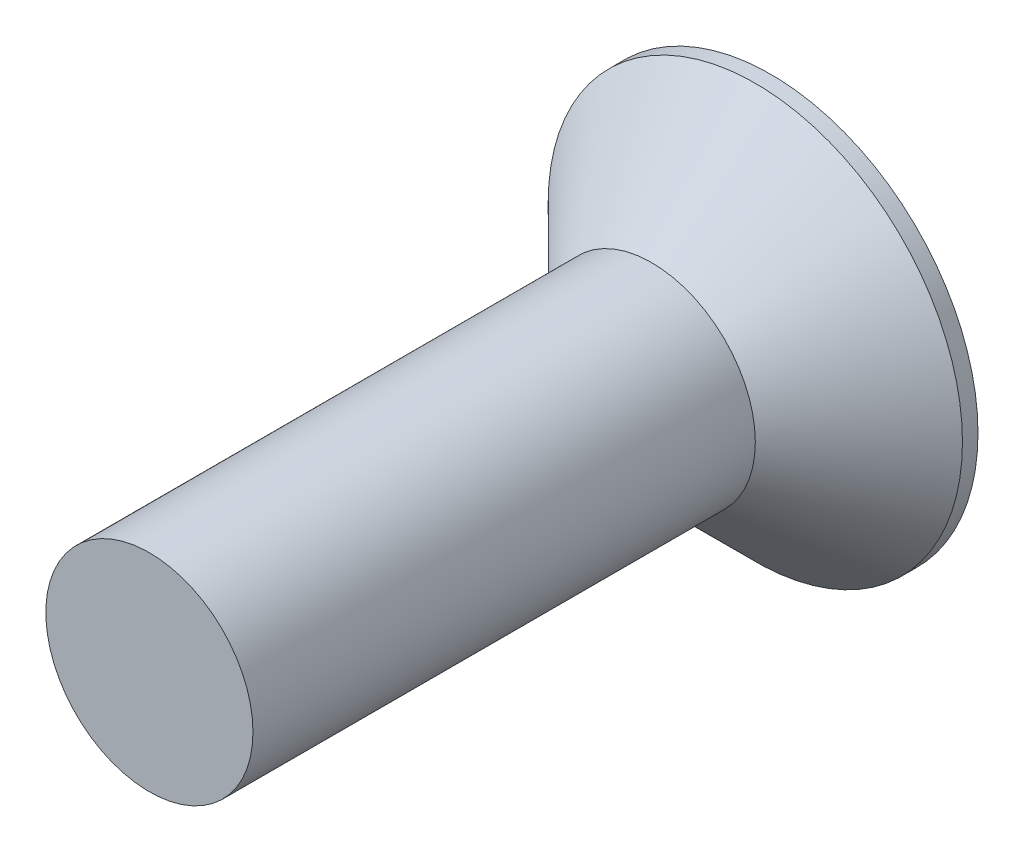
SolidWorks part; units mm, degrees
ref_plane "Front Plane" through (0, 0, 0) normal (0, 0, 1) x (1, 0, 0)
ref_plane "Top Plane" through (0, 0, 0) normal (0, 1, 0) x (1, 0, 0)
ref_plane "Right Plane" through (0, 0, 0) normal (1, 0, 0) x (0, 0, -1)
sketch "Sketch6" plane through (0, 0, 0) normal (1, 0, 0) x (0, 0, -1)
  line L0 (-12, 0) -> (22.525, 0) construction
  line L1 (4.4, 0) -> (-4.4, 0) construction
  line L2 (-12, 0) -> (-12, -2)
  line L3 (-12, -2) -> (-2.3, -2)
  line L5 (-0.3, -4) -> (0, -4)
  line L6 (-2.3, -2) -> (-0.3, -4)
  line L7 (0, -4) -> (0, 0)
  line L8 (0, 0) -> (-12, 0)
  dimension "D1" = 45
  dimension "L" = 12
  dimension "H" = 2.3
  dimension "A" = 8
  dimension "D" = 4
revolve "Revolve1" add sketch "Sketch6" angle 360 about L0
sketch "Sketch7" plane through (0, 0, 0) normal (0, 0, -1) x (-1, 0, 0)
  line L2 (-1.25, 0.7217) -> (-1.25, -0.7217)
  line L4 (-1.25, -0.7217) -> (0, -1.4434)
  line L5 (0, -1.4434) -> (1.25, -0.7217)
  line L6 (1.25, -0.7217) -> (1.25, 0.7217)
  line L7 (1.25, 0.7217) -> (0, 1.4434)
  line L8 (0, 1.4434) -> (-1.25, 0.7217)
  circle A0 centre (0, 0) radius 1.25 construction
  dimension "J" = 2.5
extrude "HEX" cut sketch "Sketch7" against normal blind 2
